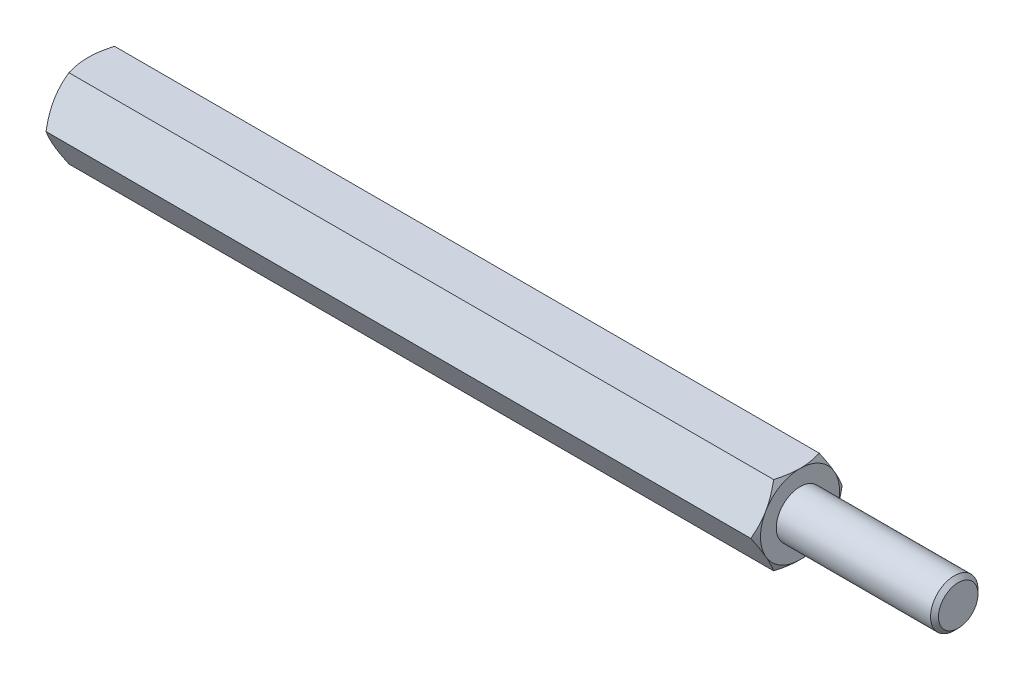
SolidWorks part; units mm, degrees
ref_plane "Front Plane" through (0, 0, 0) normal (0, 0, 1) x (1, 0, 0)
ref_plane "Top Plane" through (0, 0, 0) normal (0, 1, 0) x (1, 0, 0)
ref_plane "Right Plane" through (0, 0, 0) normal (1, 0, 0) x (0, 0, -1)
sketch "Sketch1" plane through (0, 0, 0) normal (1, 0, 0) x (0, 0, -1)
  line L1 (1.4434, 2.5) -> (-1.4434, 2.5)
  line L2 (-1.4434, 2.5) -> (-2.8868, 0)
  line L3 (-2.8868, 0) -> (-1.4434, -2.5)
  line L4 (-1.4434, -2.5) -> (1.4434, -2.5)
  line L5 (1.4434, -2.5) -> (2.8868, 0)
  line L6 (2.8868, 0) -> (1.4434, 2.5)
  circle A0 centre (0, 0) radius 2.5 construction
  dimension "D1" = 5
extrude "Extrude2" add sketch "Sketch1" along normal mid plane 45
sketch "Sketch2" plane through (0, 0, 0) normal (0, 0, 1) x (1, 0, 0)
  line L0 (-22.5, 2.5) -> (-21, 5.0981)
  line L1 (-22.5, 5.5) -> (-22.5, 2.5)
  line L3 (0, 0) -> (50000, 0) construction
  arc A0 (-21, 5.0981) -> (-22.5, 5.5) centre (-21.6962, 5.5) ccw
  dimension "D1" = 30
  dimension "D2" = 3
revolve "Cut-Revolve1" cut sketch "Sketch2" angle 360 about L3
mirror "Mirror1" about plane through (0, 0, 0) normal (1, 0, 0) of "Cut-Revolve1"
sketch "Sketch3" plane through (-22.5, 0, 0) normal (-1, 0, 0) x (0, 0, 1)
  circle A0 centre (0, 0) radius 1.25
  dimension "D1" = 2.5
extrude "Extrude3" cut sketch "Sketch3" against normal blind 10
sketch "Sketch4" plane through (0, 0, 0) normal (0, 0, 1) x (1, 0, 0)
  line L0 (-12.5, 0) -> (-12.5, 1.25)
  line L1 (22.2767, 0) -> (-22.2767, 0) construction
  line L2 (-12.5, 1.25) -> (-11.7783, 0)
  line L3 (-11.7783, 0) -> (-12.5, 0)
  line L4 (-22.5, 1.25) -> (-22.5, -1.25) construction
  point P4 (-22.5, 0)
  dimension "D1" = 30
  dimension "D2" = 1.25
  dimension "D3" = 10
revolve "Cut-Revolve2" cut sketch "Sketch4" angle 360 about L3
sketch "Sketch5" plane through (22.5, 0, 0) normal (1, 0, 0) x (0, 0, -1)
  circle A0 centre (0, 0) radius 1.5
  dimension "D1" = 3
extrude "Extrude4" add sketch "Sketch5" along normal blind 10
chamfer "Chamfer1" distance 0.25 angle 45 1 edges at (32.5, 0, -1.5)
equation "\"D2@Sketch4\" = \"D1@Sketch3\"/2"
